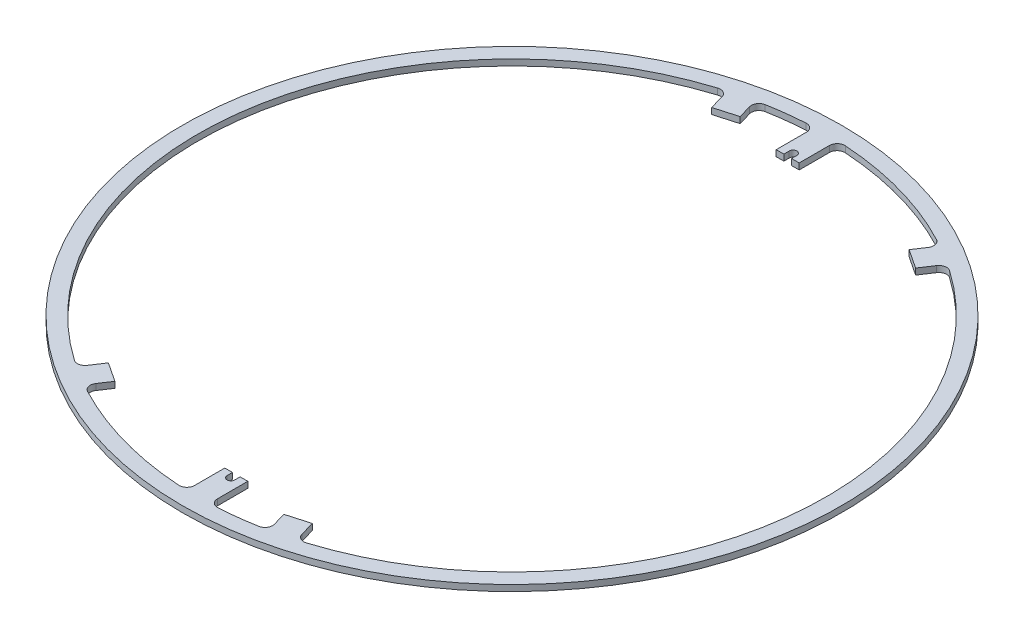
SolidWorks part; units mm, degrees
ref_plane "前视基准面" through (0, 0, 0) normal (0, 0, 1) x (1, 0, 0)
ref_plane "上视基准面" through (0, 0, 0) normal (0, 1, 0) x (1, 0, 0)
ref_plane "右视基准面" through (0, 0, 0) normal (1, 0, 0) x (0, 0, -1)
sketch "草图1" plane through (0, 0, 0) normal (0, 1, 0) x (1, 0, 0)
  circle A0 centre (0, 0) radius 43
  circle A1 centre (0, 0) radius 41
  circle A2 centre (0, 0) radius 35 construction
  dimension "D1" = 86
  dimension "D2" = 2
  dimension "D3" = 70
extrude "凸台-拉伸1" add sketch "草图1" along normal blind 0.8
sketch "草图2" plane through (0, 0.8, 0) normal (0, 1, 0) x (1, 0, 0)
  line L0 (0, 0) -> (0, 47.3857) construction
  line L1 (-1.5, 40.9726) -> (-1.5, 35.9726)
  line L2 (-1.5, 35.9726) -> (1.5, 35.9726)
  line L3 (1.5, 40.9726) -> (1.5, 35.9726)
  line L4 (0, 0) -> (51.4644, 0) construction
  line L5 (1.5, -40.9726) -> (1.5, -35.9726)
  line L6 (-1.5, -40.9726) -> (-1.5, -35.9726)
  line L7 (-1.5, -35.9726) -> (1.5, -35.9726)
  circle A0 centre (0, 0) radius 41 construction
  circle A1 centre (0, 0) radius 41
  point P10 (0, 35.9726)
  dimension "D1" = 5
  dimension "D2" = 3
extrude "凸台-拉伸2" add sketch "草图2" against normal up to surface (0.8 mm away) contours L7 L6 L5 M8 | L3 L1 L2 M8
fillet "圆角1" radius 1 2 edges at (1.5, 0.4, -40.9726) (-1.5, 0.4, -40.9726)
fillet "圆角2" radius 1 2 edges at (1.5, 0.4, 40.9726) (-1.5, 0.4, 40.9726)
sketch "草图3" plane through (0, 0, 0) normal (0, -1, 0) x (1, 0, 0)
  line L0 (0, 36.6726) -> (0, 35.9726) construction
  line L1 (1.5, 35.9726) -> (-1.5, 35.9726) construction
  line L2 (-0.5, 36.6726) -> (-0.5, 33.6726)
  line L3 (-0.5, 33.6726) -> (0.5, 33.6726)
  line L4 (0.5, 33.6726) -> (0.5, 36.6726)
  line L5 (0, 0) -> (11.294, 0) construction
  line L6 (0, -36.6726) -> (0, -35.9726) construction
  line L7 (0.5, -33.6726) -> (0.5, -36.6726)
  line L8 (-0.5, -33.6726) -> (0.5, -33.6726)
  line L9 (-0.5, -36.6726) -> (-0.5, -33.6726)
  arc A0 (0.5, 36.6726) -> (-0.5, 36.6726) centre (0, 36.6726) ccw
  arc A1 (0.5, -36.6726) -> (-0.5, -36.6726) centre (0, -36.6726) cw
  dimension "D1" = 1
  dimension "D2" = 3
  dimension "D3" = 0.7
extrude "切除-拉伸1" cut sketch "草图3" against normal through all
sketch "草图4" plane through (0, 0.8, 0) normal (0, 1, 0) x (1, 0, 0)
  line L0 (0, 0) -> (-22.6294, -34.1893) construction
  line L1 (0, 0) -> (0, -48.4381) construction
  line L2 (-22.6294, -34.1893) -> (-20.9736, -31.6877)
  line L3 (-20.9736, -31.6877) -> (-18.4719, -33.3435)
  line L4 (-18.4719, -33.3435) -> (-20.0671, -35.7535)
  line L5 (22.6294, 34.1893) -> (20.9736, 31.6877)
  line L6 (20.9736, 31.6877) -> (18.4719, 33.3435)
  line L7 (18.4719, 33.3435) -> (20.0671, 35.7535)
  arc A0 (-2.5625, 40.9198) -> (-2.5625, -40.9198) centre (0, 0) ccw construction
  arc A1 (-22.6294, -34.1893) -> (-20.0671, -35.7535) centre (0, 0) ccw
  arc A2 (22.6294, 34.1893) -> (20.0671, 35.7535) centre (0, 0) ccw
  point P16 (0, 0)
  dimension "D1" = 3
  dimension "D2" = 3
  dimension "D4" = 33.5
  dimension "D3" = 2
extrude "凸台-拉伸3" add sketch "草图4" against normal up to surface (0.8 mm away)
fillet "圆角3" radius 1 4 edges at (22.6294, 0.4, -34.1893) (20.0671, 0.4, -35.7535) (-20.0671, 0.4, 35.7535) (-22.6294, 0.4, 34.1893)
sketch "草图5" plane through (0, 0, 0) normal (0, -1, 0) x (1, 0, 0)
  line L0 (0, 0) -> (-20.9736, 31.6877) construction
  line L1 (0, 0) -> (13.3123, 46.4257) construction
  line L2 (11.3011, 39.4117) -> (10.4742, 36.5279)
  line L3 (10.4742, 36.5279) -> (7.5904, 37.3549)
  line L4 (7.5904, 37.3549) -> (8.3871, 40.133)
  line L5 (-7.5904, -37.3549) -> (-8.3871, -40.133)
  line L6 (-10.4742, -36.5279) -> (-7.5904, -37.3549)
  line L7 (-11.3011, -39.4117) -> (-10.4742, -36.5279)
  arc A0 (23.4771, -33.6129) -> (2.5625, 40.9198) centre (0, 0) ccw construction
  arc A1 (11.3011, 39.4117) -> (8.3871, 40.133) centre (0, 0) ccw
  arc A2 (-11.3011, -39.4117) -> (-8.3871, -40.133) centre (0, 0) ccw
  point P18 (0, 0)
  dimension "D1" = 49.5
  dimension "D2" = 3
  dimension "D3" = 3
  dimension "D4" = 2
extrude "凸台-拉伸4" add sketch "草图5" against normal up to surface (0.8 mm away)
fillet "圆角4" radius 1 4 edges at (-11.3011, 0.4, -39.4117) (-8.3871, 0.4, -40.133) (8.3871, 0.4, 40.133) (11.3011, 0.4, 39.4117)
